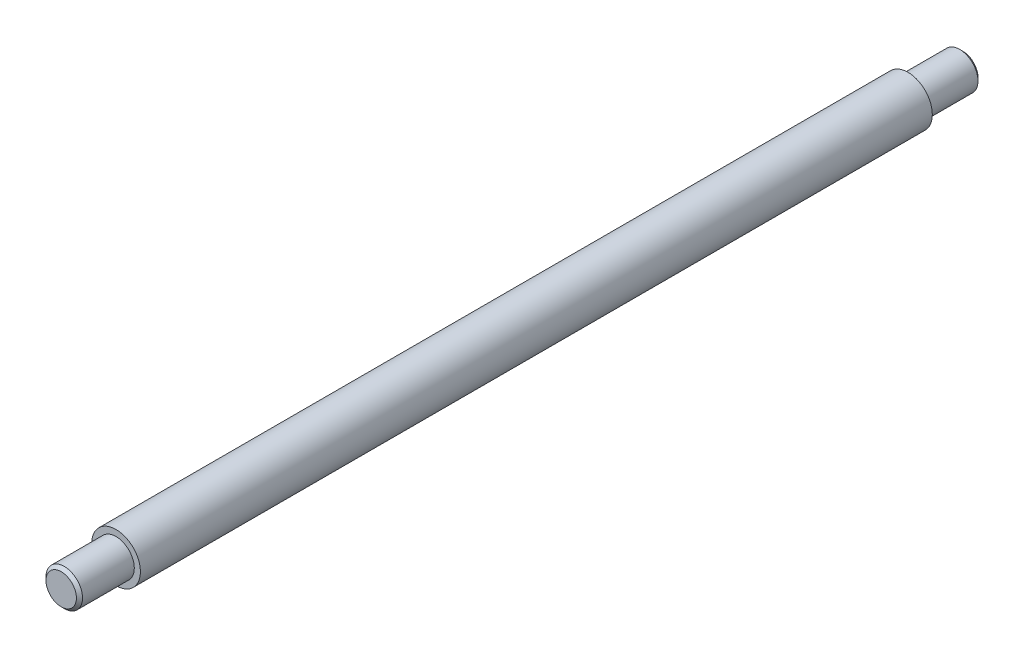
SolidWorks part; units mm, degrees
ref_plane "plan médian" through (0, 0, 0) normal (0, 0, 1) x (1, 0, 0)
ref_plane "Plan2" through (0, 0, 0) normal (0, 1, 0) x (1, 0, 0)
ref_plane "Plan3" through (0, 0, 0) normal (1, 0, 0) x (0, 0, -1)
sketch "Esquisse1" plane through (0, 0, 0) normal (0, 0, 1) x (1, 0, 0)
  circle A0 centre (0, 0) radius 4
  dimension "D1" = 8
extrude "corps de 8" add sketch "Esquisse1" along normal mid plane 130
sketch "Esquisse2" plane through (0, 0, 65) normal (0, 0, 1) x (1, 0, 0)
  circle A0 centre (0, 0) radius 3
  dimension "D1" = 6
extrude "tourillon de 6" add sketch "Esquisse2" along normal blind 9
chamfer "Chanfrein1" distance 0.5 angle 45
mirror "Symétrie1" about plane through (0, 0, 0) normal (0, 0, 1)
